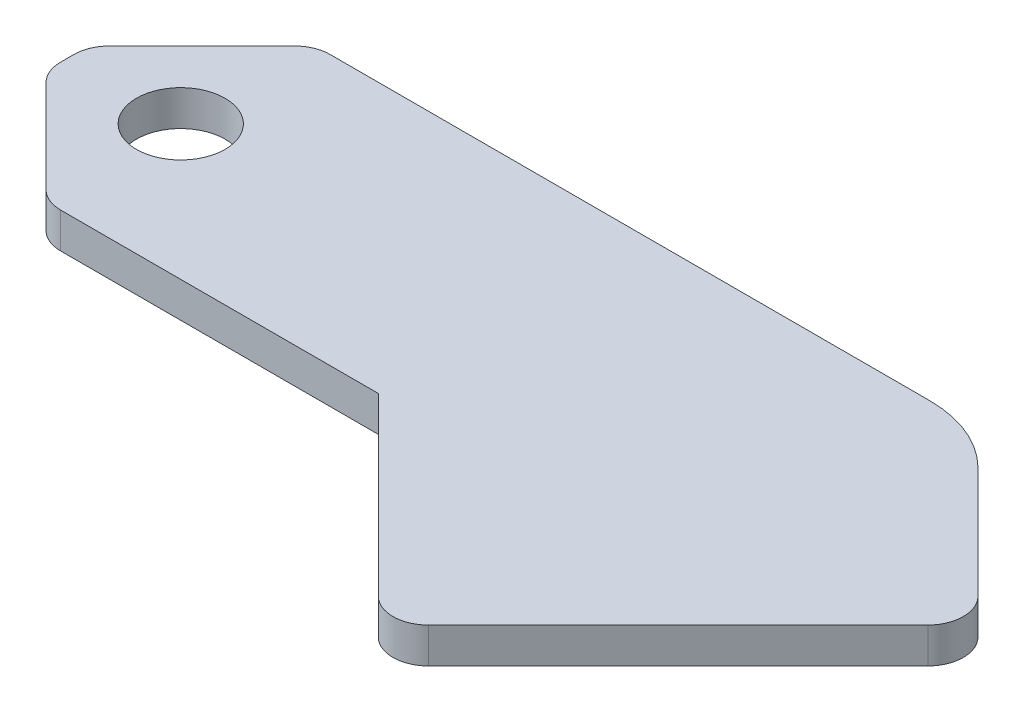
SolidWorks part; units mm, degrees
ref_plane "Plan de face" through (0, 0, 0) normal (0, 0, 1) x (1, 0, 0)
ref_plane "Plan de dessus" through (0, 0, 0) normal (0, 1, 0) x (1, 0, 0)
ref_plane "Plan de droite" through (0, 0, 0) normal (1, 0, 0) x (0, 0, -1)
ref_plane "Plan1" through (0, 2.5, 0) normal (0, 1, 0) x (1, 0, 0)
sketch "Esquisse1" plane through (0, 2.5, 0) normal (0, 1, 0) x (1, 0, 0)
  line L0 (-14.5355, -4.4645) -> (-1.4645, -17.5355)
  line L1 (2.0711, -19) -> (46.8528, -19)
  line L2 (46.8528, -19) -> (71.6016, -43.7487)
  line L3 (78.6726, -43.7487) -> (113.8865, -8.5348)
  line L4 (113.8865, -1.4638) -> (98.2145, 14.2083)
  line L5 (86.6463, 19) -> (2.0711, 19)
  line L6 (-1.4645, 17.5355) -> (-14.5355, 4.4645)
  line L7 (-16, 0.9289) -> (-16, -0.9289)
  circle A0 centre (0, 0) radius 6.25
  arc A1 (-1.4645, -17.5355) -> (2.0711, -19) centre (2.0711, -14) ccw
  arc A2 (71.6016, -43.7487) -> (78.6726, -43.7487) centre (75.1371, -40.2132) ccw
  arc A3 (113.8865, -8.5348) -> (113.8865, -1.4638) centre (110.351, -4.9993) ccw
  arc A4 (98.2145, 14.2083) -> (86.6463, 19) centre (86.6463, 2.64) ccw
  arc A5 (2.0711, 19) -> (-1.4645, 17.5355) centre (2.0711, 14) ccw
  arc A6 (-14.5355, 4.4645) -> (-16, 0.9289) centre (-11, 0.9289) ccw
  arc A7 (-16, -0.9289) -> (-14.5355, -4.4645) centre (-11, -0.9289) ccw
extrude "Boss.-Extru.1" add sketch "Esquisse1" against normal blind 5
